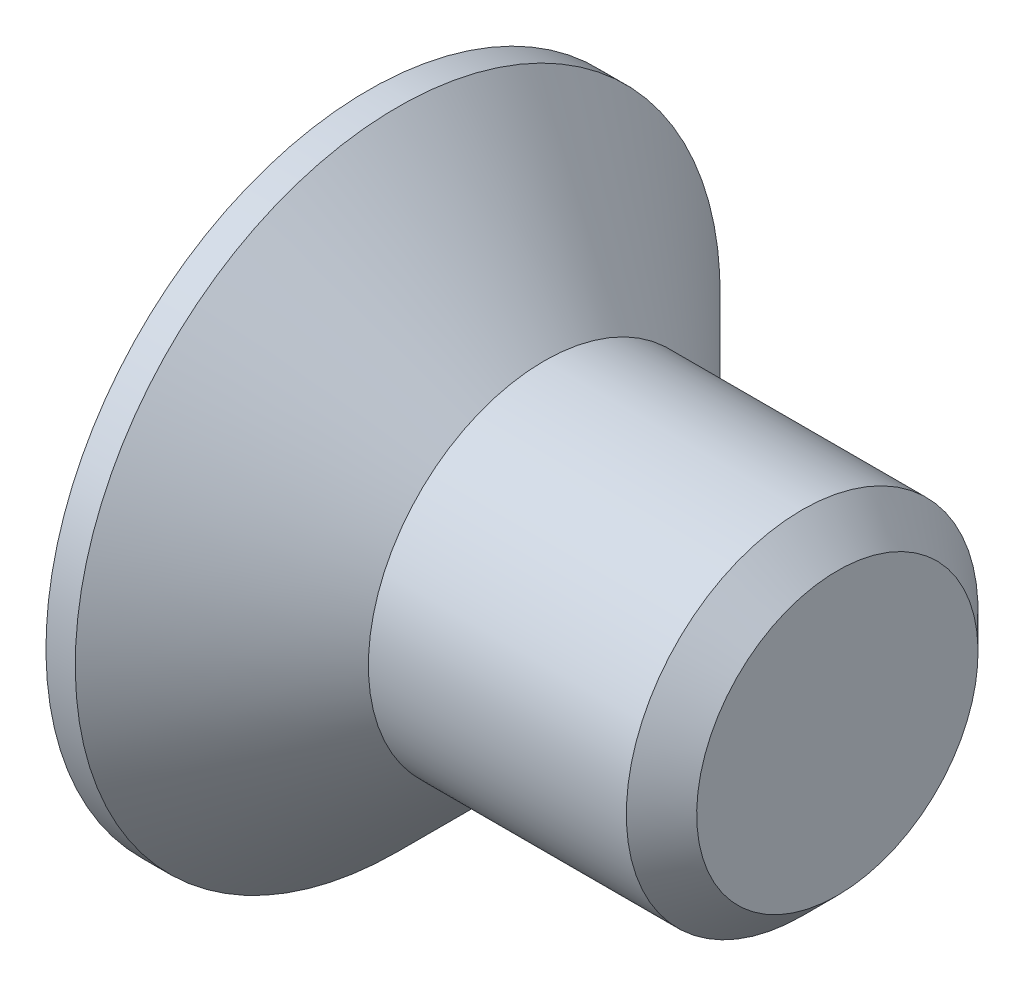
SolidWorks part; units mm, degrees
ref_plane "Front Plane" through (0, 0, 0) normal (0, 0, 1) x (1, 0, 0)
ref_plane "Top Plane" through (0, 0, 0) normal (0, 1, 0) x (1, 0, 0)
ref_plane "Right Plane" through (0, 0, 0) normal (1, 0, 0) x (0, 0, -1)
sketch "Sketch1" plane through (0, 0, 0) normal (0, 0, 1) x (1, 0, 0)
  line L1 (-3, 5.5) -> (-3, 0)
  line L2 (-3, 0) -> (5, 0)
  line L3 (5, 0) -> (5, 3)
  line L4 (5, 3) -> (0, 3)
  line L5 (-3, 5.5) -> (-2.5, 5.5)
  line L6 (-2.5, 5.5) -> (0, 3)
  dimension "D1" = 3
  dimension "D2" = 45
  dimension "D3" = 3
  dimension "D4" = 8
  dimension "D5" = 5.5
revolve "Revolve1" add sketch "Sketch1" angle 360 about L2
chamfer "Chamfer1" distance 0.6 angle 45 1 edges at (5, -3, 0)
sketch "Sketch2" plane through (-3, 0, 0) normal (-1, 0, 0) x (0, 0, 1)
  line L0 (-0.825, 3.3) -> (0.825, 3.3)
  line L1 (0.825, 3.3) -> (0.825, 0.825)
  line L2 (0.825, 0.825) -> (3.3, 0.825)
  line L3 (3.3, 0.825) -> (3.3, -0.825)
  line L4 (3.3, -0.825) -> (0.825, -0.825)
  line L5 (0.825, -0.825) -> (0.825, -3.3)
  line L6 (0.825, -3.3) -> (-0.825, -3.3)
  line L7 (-0.825, -3.3) -> (-0.825, -0.825)
  line L8 (-0.825, -0.825) -> (-3.3, -0.825)
  line L9 (-3.3, -0.825) -> (-3.3, 0.825)
  line L10 (-3.3, 0.825) -> (-0.825, 0.825)
  line L11 (-0.825, 0.825) -> (-0.825, 3.3)
  point P2 (0, 3.3)
  point P14 (0, -3.3)
  point P15 (3.3, 0)
  point P16 (-3.3, 0)
  point P17 (0.2443, 1.0495)
  point P18 (1.175, 0.2864)
  dimension "D1" = 6.6
  dimension "D2" = 1.65
extrude "Cut-Extrude1" cut sketch "Sketch2" against normal blind 2.5
